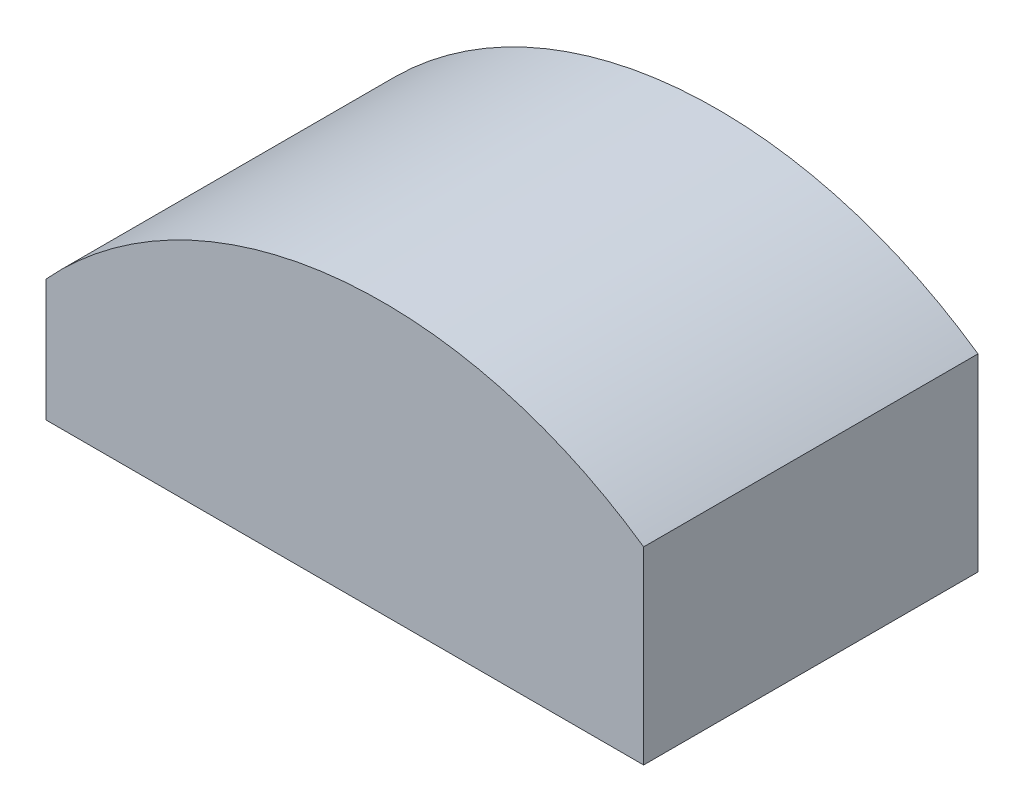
SolidWorks part; units mm, degrees
ref_plane "Front" through (0, 0, 0) normal (0, 0, 1) x (1, 0, 0)
ref_plane "Top" through (0, 0, 0) normal (0, 1, 0) x (1, 0, 0)
ref_plane "Right" through (0, 0, 0) normal (1, 0, 0) x (0, 0, -1)
sketch "Sketch1" plane through (0, 0, 0) normal (0, 0, 1) x (1, 0, 0)
  line L1 (0, 0) -> (109.0296, 0)
  line L2 (0, 0) -> (0, 51.429)
  line L3 (0, 51.429) -> (109.0296, 51.429)
  line L4 (109.0296, 0) -> (109.0296, 51.429)
extrude "Extrude1" add sketch "Sketch1" along normal blind 61
sketch "Sketch2" plane through (0, 0, 61) normal (0, 0, 1) x (1, 0, 0)
  arc A0 (-4.2733, 17.2004) -> (112.6542, 31.7961) centre (61.4883, -33.9655) cw
surface "Surface-Extrude1" sketch "Sketch2" parameters "D1"=19.1969, "D2"=79
other "SurfaceCut1"
